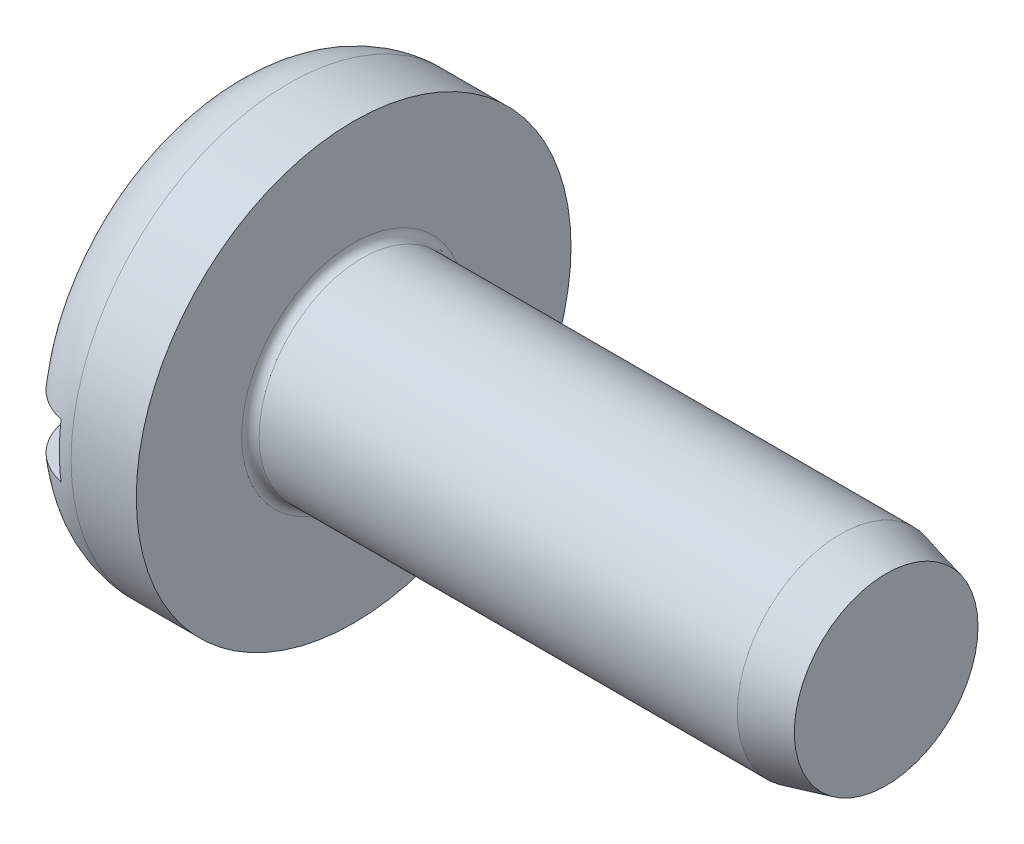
SolidWorks part; units mm, degrees
ref_plane "Front" through (0, 0, 0) normal (0, 0, 1) x (1, 0, 0)
ref_plane "Top" through (0, 0, 0) normal (0, 1, 0) x (1, 0, 0)
ref_plane "Right" through (0, 0, 0) normal (1, 0, 0) x (0, 0, -1)
other "Configuration Table"
sketch "Sketch1" plane through (0, 0, 0) normal (0, 0, 1) x (1, 0, 0)
  line L0 (-65.8852, 0) -> (41.8165, 0) construction
  line L1 (30.5, 0) -> (30.5, 4.75)
  line L2 (30.5, 4.75) -> (6, 4.75)
  line L3 (6, 4.75) -> (6, 10)
  line L4 (6, 10) -> (3, 10)
  line L5 (30.5, 0) -> (0, 0)
  line L6 (0, 7) -> (0, 0)
  line L7 (8.1, 7) -> (8.1, -1.5464) construction
  arc A0 (3, 10) -> (0, 7) centre (3, 7) ccw
revolve "Base" add sketch "Sketch1" angle 360 about L0
sketch "Sketch2" plane through (0, 0, 0) normal (0, 0, 1) x (1, 0, 0)
  line L1 (0, 1.25) -> (2.4, 1.25)
  line L2 (0, 1.25) -> (0, -1.25)
  line L3 (0, -1.25) -> (2.4, -1.25)
  line L4 (2.4, 1.25) -> (2.4, -1.25)
  line L5 (0, 7) -> (0, -7) construction
  line L6 (1.1738, 0) -> (-4.2219, 0) construction
  dimension "n" = 2.5
  dimension "t" = 2.4
extrude "Slot" cut sketch "Sketch2" against normal through all and the other way through all
fillet "Fillet1" radius 0.4 1 edges at (6, 0, 4.75)
sketch "Sketch3" plane through (0, 0, 0) normal (0, 0, 1) x (1, 0, 0)
  line L0 (1.3282, 0) -> (-13.6388, 0) construction
  line L2 (26.3, -4.75) -> (28.4, -4.75)
  line L3 (28.4, -4.75) -> (30.5, -4.225)
  line L6 (26.3, -4.75) -> (26.3, -5.25)
  line L7 (26.3, -5.25) -> (30.5, -5.25)
  line L8 (30.5, -5.25) -> (30.5, -4.225)
  line L9 (30.5, -4.75) -> (30.5, 4.75) construction
  line L10 (6.4, -4.75) -> (30.5, -4.75) construction
  point P15 (28.4, -4.75)
revolve "Cut-Revolve1" cut sketch "Sketch3" angle 360 about L0
sketch "Sketch4" plane through (0, 0, 0) normal (0, 0, 1) x (1, 0, 0)
  line L0 (33.2407, 0) -> (9.9121, 0) construction
  line L2 (30.5, -4.75) -> (30.5, 4.75) construction
  line L3 (30.5, 0) -> (22.5, -4.75) construction
  line L6 (30.5, 0) -> (31, 0)
  line L7 (22.5, -4.75) -> (30.5, -4.75)
  line L8 (31, 0) -> (31, -4.75)
  line L9 (31, -4.75) -> (30.5, -4.75)
  arc A0 (30.5, 0) -> (22.5, -4.75) centre (10.3363, 24.8481) cw
revolve "Cut-Revolve6" [suppressed] cut sketch "Sketch4" angle 360 about L0
sketch "Sketch5" plane through (0, 0, 0) normal (0, 0, 1) x (1, 0, 0)
  line L0 (7.85, 5.25) -> (8.35, 5.25)
  line L1 (8.35, 5.25) -> (8.35, 4.75)
  line L2 (8.35, 4.75) -> (8.1, 4.317)
  line L3 (8.1, 4.317) -> (7.85, 4.75)
  line L4 (7.85, 4.75) -> (7.85, 5.25)
  line L5 (0, 0) -> (1.9875, 0) construction
  line L6 (6, -10) -> (6, 10) construction
revolve "Cut-Revolve10" [suppressed] cut sketch "Sketch5" angle 360 about L5
pattern_linear "LPattern10" [suppressed] count 37 spacing 0.6 along (1, 0, 0)
equation "\"D3@Sketch3\" = \"yf@Sketch3\" / 8"
equation "\"D2@ThreadCosmetic1\" = \"st@Sketch1\" - 1"
equation "\"D1@Sketch4\" = \"yc@Sketch4\" * 4"
equation "\"D3@Sketch4\" = \"st@Sketch1\""
equation "\"D2@Sketch3\" = \"yf@Sketch3\" / 2"
equation "\"D1@ThreadCosmetic1\" = \"l@Sketch1\" - \"a@Sketch1\""
equation "\"D1@Sketch5\" = \"st@Sketch1\""
equation "\"D2@Sketch5\" =  ( \"st@Sketch1\" - \"D2@ThreadCosmetic1\" )  / 2"
equation "\"D3@Sketch5\" = \"a@Sketch1\""
equation "\"D3@LPattern10\" =  ( \"st@Sketch1\" - \"D2@ThreadCosmetic1\" )  / 2 * 1.2"
equation "\"D1@LPattern10\" = \"D1@ThreadCosmetic1\" / \"D3@LPattern10\""
